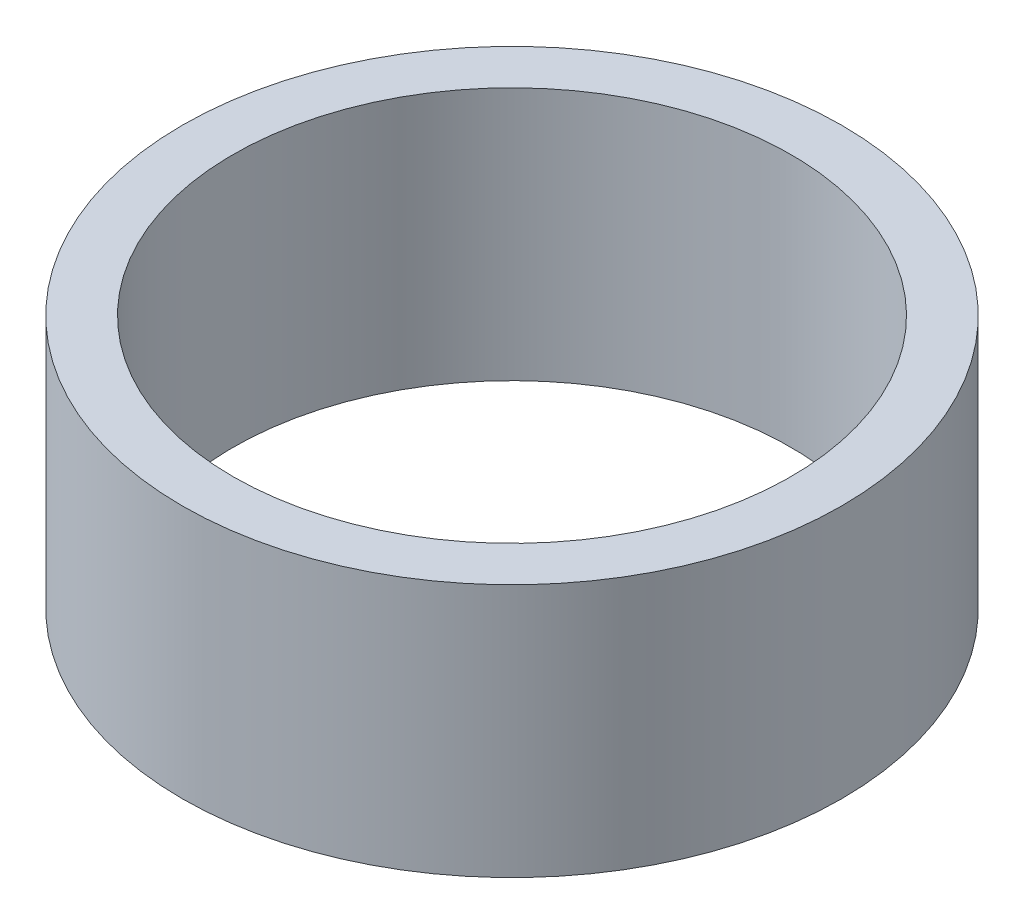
SolidWorks part; units mm, degrees
ref_plane "前基準面" through (0, 0, 0) normal (0, 0, 1) x (1, 0, 0)
ref_plane "上基準面" through (0, 0, 0) normal (0, 1, 0) x (1, 0, 0)
ref_plane "右基準面" through (0, 0, 0) normal (1, 0, 0) x (0, 0, -1)
sketch "Sketch1" plane through (0, 0, 0) normal (0, 1, 0) x (1, 0, 0)
  circle A0 centre (0, 0) radius 65
  circle A1 centre (0, 0) radius 55
extrude "Boss-Extrude1" add sketch "Sketch1" along normal blind 50
